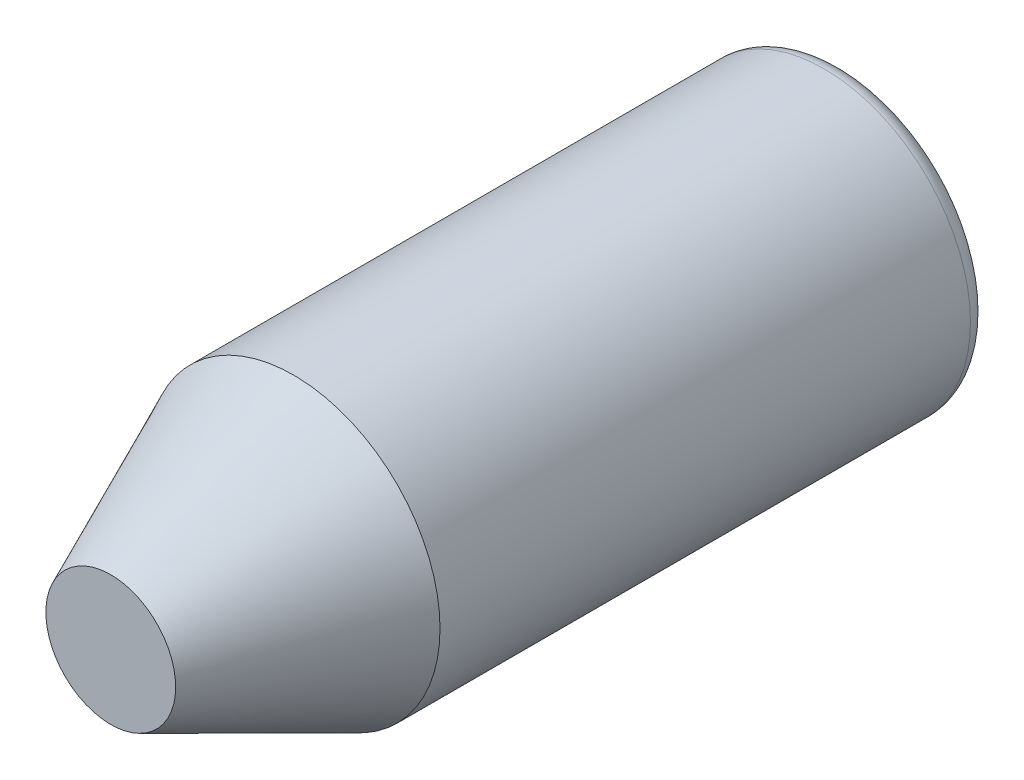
SolidWorks part; units mm, degrees
ref_plane "Plan de face" through (0, 0, 0) normal (0, 0, 1) x (1, 0, 0)
ref_plane "Plan de dessus" through (0, 0, 0) normal (0, 1, 0) x (1, 0, 0)
ref_plane "Plan de droite" through (0, 0, 0) normal (1, 0, 0) x (0, 0, -1)
sketch "Esquisse1" plane through (0, 0, 0) normal (0, 0, 1) x (1, 0, 0)
  circle A0 centre (0, 0) radius 40
  dimension "D1" = 80
extrude "Boss.-Extru.1" add sketch "Esquisse1" along normal blind 150
fillet "Congé1" radius 5 1 edges at (40, 0, 0)
sketch "Esquisse2" plane through (0, 0, 150) normal (0, 0, 1) x (1, 0, 0)
  circle A1 centre (0, 0) radius 40
  circle A2 centre (0, 0) radius 40
  dimension "D1" = 0
extrude "Boss.-Extru.2" add sketch "Esquisse2" along normal blind 50 draft 24
sketch "Esquisse3" plane through (0, 0, 200) normal (0, 0, 1) x (1, 0, 0)
  circle A0 centre (0, 0) radius 4.716
extrude "Boss.-Extru.3" add sketch "Esquisse3" along normal blind 50
sketch "Esquisse4" plane through (0, 0, 250) normal (0, 0, 1) x (1, 0, 0)
  circle A0 centre (0, 0) radius 17.44
extrude "Boss.-Extru.4" add sketch "Esquisse4" against normal blind 5
fillet "Congé2" radius 2 1 edges at (17.44, 0, 250)
sketch "Esquisse5" plane through (0, 0, 0) normal (0, 1, 0) x (1, 0, 0)
  circle A0 centre (0, -220.1474) radius 4.716
sketch "Esquisse6" plane through (0, 0, 0) normal (1, 0, 0) x (0, 0, -1)
  line L0 (-220.1474, 0) -> (-220.1474, 23.0189)
  line L1 (-215.4314, 0) -> (-224.8633, 0) construction
  line L2 (-220.1474, 23.0189) -> (-204.4987, 57.6695)
sweep "Balayage1" add profiles "Esquisse5" path "Esquisse6"
sketch "Esquisse7" plane through (0, 0, 200) normal (0, 0, 1) x (1, 0, 0)
  circle A0 centre (0, 0) radius 95.5813
extrude "Enlèv. mat.-Extru.1" cut sketch "Esquisse7" along normal through all
